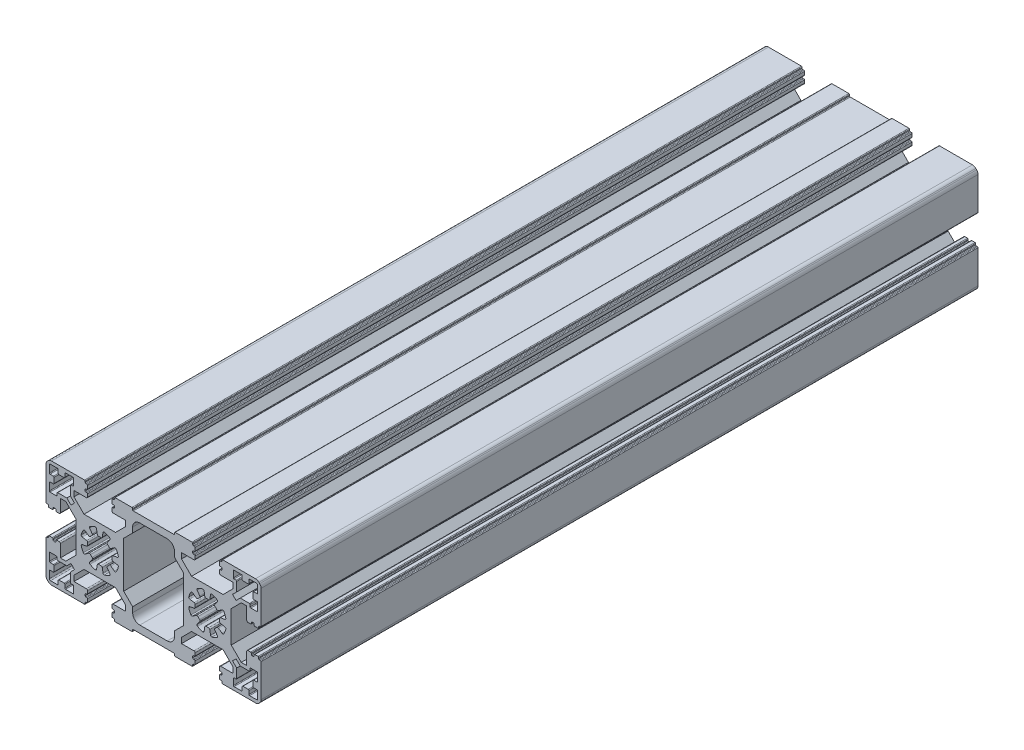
SolidWorks part; units mm, degrees
ref_plane "前视基准面" through (0, 0, 0) normal (0, 0, 1) x (1, 0, 0)
ref_plane "上视基准面" through (0, 0, 0) normal (0, 1, 0) x (1, 0, 0)
ref_plane "右视基准面" through (0, 0, 0) normal (1, 0, 0) x (0, 0, -1)
sketch "草图1"
sketch_block_instance "A$C4E8A54CA-1"
sketch_block "A$C4E8A54CA"
extrude "凸台-拉伸1" add sketch "草图1" along normal mid plane 300
